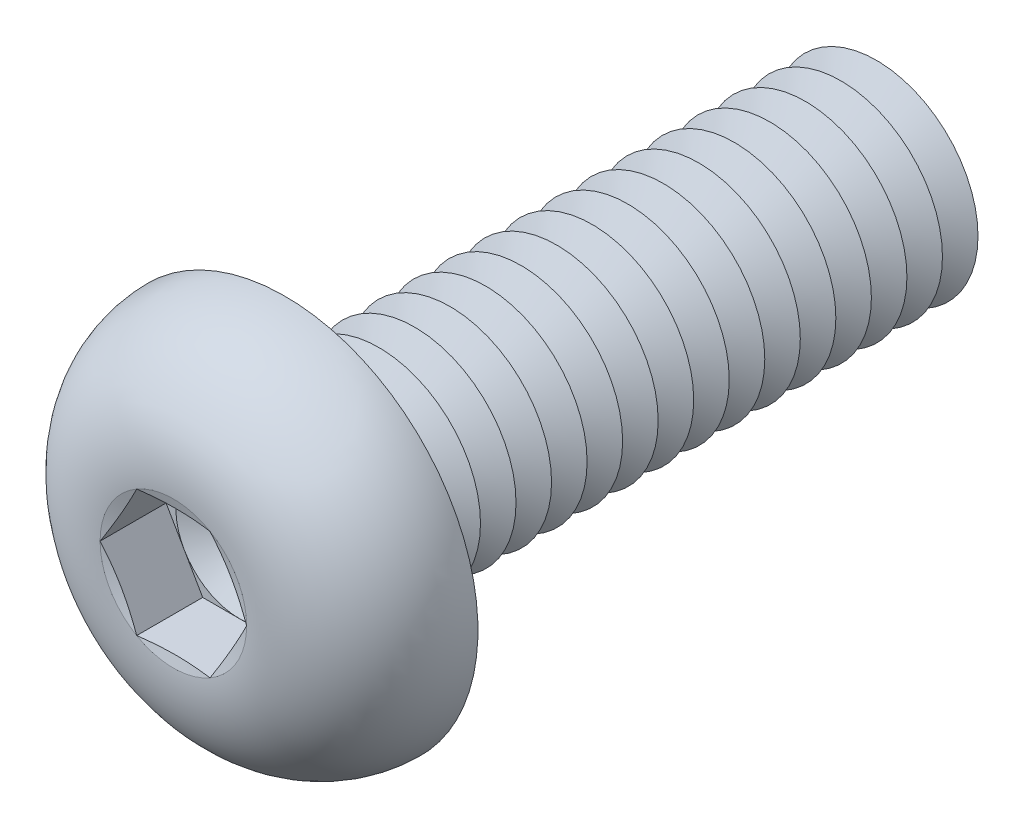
SolidWorks part; units mm, degrees
ref_plane "Front Plane" through (0, 0, 0) normal (0, 0, 1) x (1, 0, 0)
ref_plane "Top Plane" through (0, 0, 0) normal (0, 1, 0) x (1, 0, 0)
ref_plane "Right Plane" through (0, 0, 0) normal (1, 0, 0) x (0, 0, -1)
sketch "Sketch1" plane through (0, 0, 0) normal (1, 0, 0) x (0, 0, -1)
  line L0 (0, 2) -> (0, 3.8)
  line L3 (0, 2) -> (12, 2)
  line L4 (12, 2) -> (12, 0)
  line L5 (12, 0) -> (-2.2, 0) construction
  line L6 (-2.2, 0) -> (12, 0)
  line L7 (-2.2, 1.4434) -> (-2.2, 0.7217) construction
  line L8 (-2.2, 0.7217) -> (-2.2, 0)
  line L9 (-2.2, 1.4434) -> (-2.0066, 0.7217)
  line L10 (-2.0066, 0.7217) -> (-2.2, 0.7217)
  line L11 (12, 0) -> (22.7481, 0) construction
  line L12 (0, 3.8) -> (-2.2, 3.8) construction
  arc A1 (0, 3.8) -> (-2.2, 1.4434) centre (0, 1.5948) ccw
  point P8 (12, 1)
  dimension "D1" = 7.6
  dimension "D2" = 4
  dimension "D3" = 2.2
  dimension "D4" = 2.8868
  dimension "D5" = 12
  dimension "D6" = 15
revolve "Revolve1" add sketch "Sketch1" angle 360 about L5
fillet "Fillet1" radius 0.35 1 edges at (-2, 0, 0)
sketch "Sketch2" plane through (0, 0, 0) normal (1, 0, 0) x (0, 0, -1)
  line L0 (11.65, 2) -> (12.35, 2)
  line L1 (12, 2) -> (0.35, 2) construction
  line L2 (12.35, 2) -> (12, 1.3938)
  line L3 (12, -2) -> (12, 2) construction
  line L4 (12, 1.3938) -> (11.65, 2)
  dimension "D1" = 0.7
revolve "Cut-Revolve1" cut sketch "Sketch2" angle 360 about axis through (0, 0, -12) along (0, 0, -1)
pattern_linear "LPattern1" count 17 spacing 0.7 along (0, 0, 1) of "Cut-Revolve1"
sketch "Sketch3" plane through (0, 0, 2.2) normal (0, 0, 1) x (1, 0, 0)
  line L7 (0.7217, 1.25) -> (-0.7217, 1.25)
  line L8 (-0.7217, 1.25) -> (-1.4434, 0)
  line L9 (-1.4434, 0) -> (-0.7217, -1.25)
  line L10 (-0.7217, -1.25) -> (0.7217, -1.25)
  line L11 (0.7217, -1.25) -> (1.4434, 0)
  line L12 (1.4434, 0) -> (0.7217, 1.25)
  circle A0 centre (0, 0) radius 1.25 construction
  circle A3 centre (0, 0) radius 1.4434 construction
extrude "Cut-Extrude1" cut sketch "Sketch3" against normal blind 1.3
sketch "Sketch4" plane through (0, 0, 0.9) normal (0, 0, 1) x (1, 0, 0)
  line L1 (0.7217, 1.25) -> (-0.7217, 1.25) construction
  circle A0 centre (0, 0) radius 1.25
extrude "Cut-Extrude2" cut sketch "Sketch4" against normal through all draft 60
